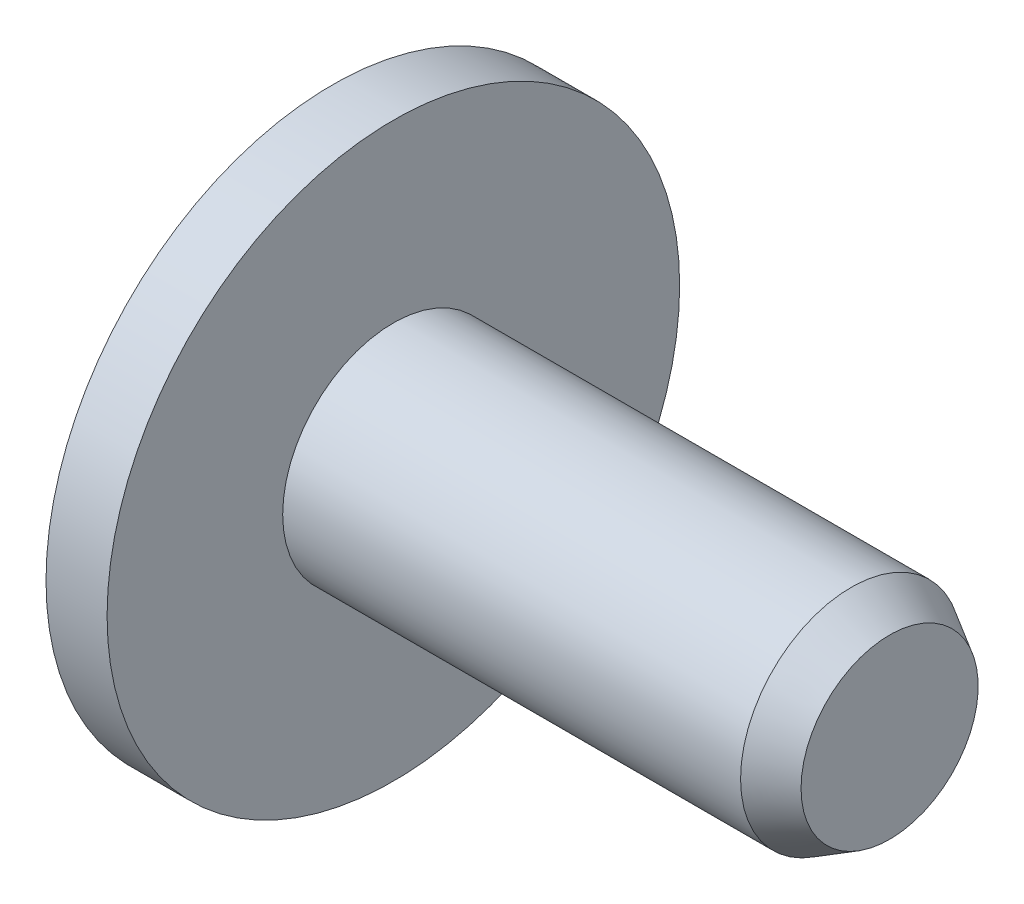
SolidWorks part; units mm, degrees
ref_plane "Front" through (0, 0, 0) normal (0, 0, 1) x (1, 0, 0)
ref_plane "Top" through (0, 0, 0) normal (0, 1, 0) x (1, 0, 0)
ref_plane "Right" through (0, 0, 0) normal (1, 0, 0) x (0, 0, -1)
sketch "Sketch1" plane through (0, 0, 0) normal (0, 0, 1) x (1, 0, 0)
  line L0 (0, 3.75) -> (0, 1.45)
  line L1 (0, 1.45) -> (6.5, 1.45)
  line L2 (6.5, 1.45) -> (6.5, 0)
  line L3 (0, 3.75) -> (-0.8, 3.75)
  line L4 (-0.8, 3.75) -> (-0.8, 3.0623)
  line L5 (-2.35, 0) -> (-2.35, -1.3041) construction
  line L7 (-6.4783, 0) -> (12.5724, 0) construction
  line L8 (-2.35, 0) -> (6.5, 0)
  arc A0 (-0.8, 3.0623) -> (-2.35, 0) centre (1.45, 0) ccw
  dimension "rf" = 3.8
  dimension "k" = 2.35
  dimension "dk" = 7.5
  dimension "c" = 0.8
  dimension "d" = 2.9
  dimension "l" = 6.5
revolve "Revolve1" add sketch "Sketch1" angle 360 about L7
chamfer "Chamfer1" distance 0.29 angle 60 1 edges at (6.5, 0, 1.45)
sketch "Sketch9" plane through (0, 0, 0) normal (0, 0, 1) x (1, 0, 0)
  line L0 (0.096, 0.7) -> (0.4811, 0.7)
  line L1 (0.4811, 0.7) -> (0.0481, 1.45)
  line L2 (0.096, 0.7) -> (0.529, 1.45)
  line L3 (0.0481, 1.45) -> (0.0481, 1.7)
  line L4 (0.529, 1.45) -> (0.529, 1.7)
  line L5 (0.0481, 1.7) -> (0.529, 1.7)
  line L6 (0.2886, 0.7) -> (0.2886, 0) construction
  line L7 (0, 0) -> (7.3035, 0) construction
  line L8 (0, -1.45) -> (0, 1.45) construction
  line L10 (0, -3.75) -> (0, 3.75) construction
  line L11 (5.9977, 1.45) -> (0, 1.45) construction
  dimension "D2" = 60
  dimension "D3" = 0.25
  dimension "threadstart" = 0.2886
  dimension "minordia" = 1.4
  dimension "advance" = 0.4809
revolve "ThreadSchematic" [suppressed] cut sketch "Sketch9" angle 360 about L7
pattern_linear "ThdSchPat" [suppressed] count 14 spacing 0.4809 along (1, 0, 0)
sketch "Sketch2" plane through (0, 0, 0) normal (0, 0, 1) x (1, 0, 0)
  line L0 (6.5, 1.45) -> (6.5, 0) construction
  line L1 (6.5, 0) -> (6.5, 1.0614) construction
  line L2 (0, 0) -> (8.4194, 0) construction
  line L5 (6.2098, -0.4431) -> (3.9, -1.45)
  line L7 (3.9, -1.45) -> (3.9, -1.65)
  line L8 (3.9, -1.65) -> (6.7, -1.65)
  line L9 (6.7, -1.65) -> (6.7, 0)
  line L10 (6.7, 0) -> (6.5, 0)
  arc A0 (6.2098, -0.4431) -> (6.5, 0) centre (6.0167, 0) ccw
  point P6 (0, -1.45)
  dimension "D1" = 0.4833
  dimension "yr" = 2.6
  dimension "D2" = 0.2
  dimension "D3" = 0.2
revolve "EndRound" [suppressed] cut sketch "Sketch2" angle 360 about L2
sketch "Sketch8" plane through (0, 0, 0) normal (0, 0, 1) x (1, 0, 0)
  line L0 (6.5, 0) -> (6.7, 0)
  line L1 (-6.4783, 0) -> (12.5724, 0) construction
  line L2 (6.7, 0) -> (6.7, -1.65)
  line L3 (6.7, -1.65) -> (3.9, -1.65)
  line L4 (3.9, -1.65) -> (3.9, -1.45)
  line L6 (3.9, -1.45) -> (6.5, 0)
  line L7 (0, 0) -> (9.5575, 0) construction
  line L8 (0, -1.45) -> (11.5982, -1.45) construction
  dimension "yc" = 2.6
  dimension "D2" = 0.2
  dimension "D3" = 0.2
revolve "EndCone" [suppressed] cut sketch "Sketch8" angle 360 about L7
ref_plane "Plane1" through (-2.35, 0, 0) normal (1, 0, 0) x (0, 0, -1)
sketch "Sketch4" plane through (-2.35, 0, 0) normal (1, 0, 0) x (0, 0, -1)
  line L0 (0.3, 1.5) -> (-0.3, 1.5)
  line L1 (-0.3, 1.5) -> (-0.3, 0.3)
  line L2 (-0.3, 0.3) -> (-1.5, 0.3)
  line L3 (-1.5, 0.3) -> (-1.5, -0.3)
  line L4 (-1.5, -0.3) -> (-0.3, -0.3)
  line L5 (-0.3, -0.3) -> (-0.3, -1.5)
  line L6 (-0.3, -1.5) -> (0.3, -1.5)
  line L7 (0.3, -1.5) -> (0.3, -0.3)
  line L8 (0.3, -0.3) -> (1.5, -0.3)
  line L9 (1.5, -0.3) -> (1.5, 0.3)
  line L10 (1.5, 0.3) -> (0.3, 0.3)
  line L11 (0.3, 0.3) -> (0.3, 1.5)
  line L12 (1.5, 0) -> (-1.5, 0) construction
  dimension "m" = 3
  dimension "D2" = 0.6
extrude "Cut-Extrude1" cut sketch "Sketch4" along normal blind 1.58
draft "Draft1" type of draft neutral plane draft angle 35 neutral plane "Plane1" faces to draft 4 parameters "D1"=35
draft "Draft2" type of draft neutral plane draft angle 8 neutral plane "Plane1" faces to draft 8 parameters "D1"=8
fillet "Fillet1" radius 0.25 4 edges at (-1.5484, -0.1873, -0.1873) (-1.5484, -0.1873, 0.1873) (-1.5484, 0.1873, 0.1873) (-1.5484, 0.1873, -0.1873)
sketch "Sketch7" plane through (-2.35, 0, 0) normal (1, 0, 0) x (0, 0, -1)
  line L0 (-0.265, 1.3259) -> (-1.3259, 1.3259) construction
  line L1 (-1.3259, 1.3259) -> (-1.3259, 0.265) construction
  line L2 (0, 0) -> (-1.3259, 1.3259) construction
  line L3 (-0.0779, 0.3255) -> (-1.3259, 1.3259)
  line L4 (-1.3259, 1.3259) -> (-0.3255, 0.0779)
  line L5 (-0.3255, 0.0779) -> (-0.3255, 0)
  line L6 (-0.0779, 0.3255) -> (0, 0.3255)
  line L7 (0.0779, 0.3255) -> (0, 0.3255)
  line L8 (1.3259, 1.3259) -> (0.0779, 0.3255)
  line L9 (0.3255, 0.0779) -> (1.3259, 1.3259)
  line L10 (0.3255, 0.0779) -> (0.3255, 0)
  line L11 (0.3255, -0.0779) -> (0.3255, 0)
  line L12 (1.3259, -1.3259) -> (0.3255, -0.0779)
  line L13 (0.0779, -0.3255) -> (1.3259, -1.3259)
  line L14 (0.0779, -0.3255) -> (0, -0.3255)
  line L15 (-0.0779, -0.3255) -> (0, -0.3255)
  line L16 (-1.3259, -1.3259) -> (-0.0779, -0.3255)
  line L17 (-0.3255, -0.0779) -> (-1.3259, -1.3259)
  line L18 (-0.3255, -0.0779) -> (-0.3255, 0)
extrude "TypeZ" [suppressed] cut sketch "Sketch7" along normal blind 0.316 draft 2
equation "\"minordia@sketch9\" = \"D2@ThreadCosmetic\""
equation "\"D1@Chamfer1\" = \"d@Sketch1\" / 10"
equation "\"D1@Sketch2\" = \"d@Sketch1\" / 6"
equation "\"D2@Sketch4\" = \"m@Sketch4\" / 5"
equation "\"D1@TypeZ\" = \"depth@Cut-Extrude1\" * 0.2"
equation "\"D1@Fillet1\" =\"m@Sketch4\" /12"
equation "\"threadstart@Sketch9\" = \"advance@Sketch9\" * 0.6"
equation "\"D1@ThdSchPat\" = int((\"l@Sketch1\"/\"advance@Sketch9\") + 0.999)"
equation "\"D3@ThdSchPat\" = \"advance@Sketch9\""
